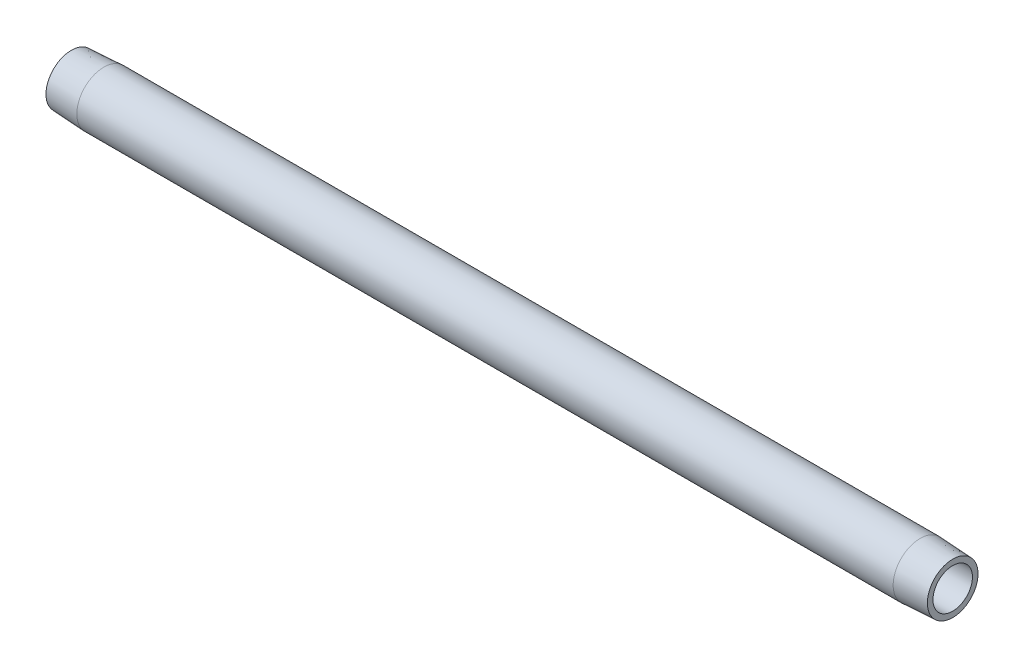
SolidWorks part; units mm, degrees
ref_plane "Front Plane" through (0, 0, 0) normal (0, 0, 1) x (1, 0, 0)
ref_plane "Top Plane" through (0, 0, 0) normal (0, 1, 0) x (1, 0, 0)
ref_plane "Right Plane" through (0, 0, 0) normal (1, 0, 0) x (0, 0, -1)
sketch "Sketch1" plane through (0, 0, 0) normal (0, 0, 1) x (1, 0, 0)
  line L5 (279.4, 6.2611) -> (0, 6.2611)
  line L6 (269.0876, 8.5725) -> (10.3124, 8.5725)
  line L7 (10.3124, 8.5725) -> (0, 8.0321)
  line L8 (279.4, 8.0321) -> (269.0876, 8.5725)
  line L9 (279.4, 6.2611) -> (279.4, 8.0321)
  line L10 (0, 6.2611) -> (0, 8.0321)
  line L11 (0, 0) -> (50000, 0) construction
  line L12 (0, -55) -> (0, 55) construction
  dimension "D1" = 12.5222
  dimension "D2" = 17.145
  dimension "D3" = 3
  dimension "D4" = 3
  dimension "D5" = 279.4
  dimension "D6" = 10.3124
  dimension "D7" = 10.3124
revolve "Revolve1" add sketch "Sketch1" angle 360 about L11
